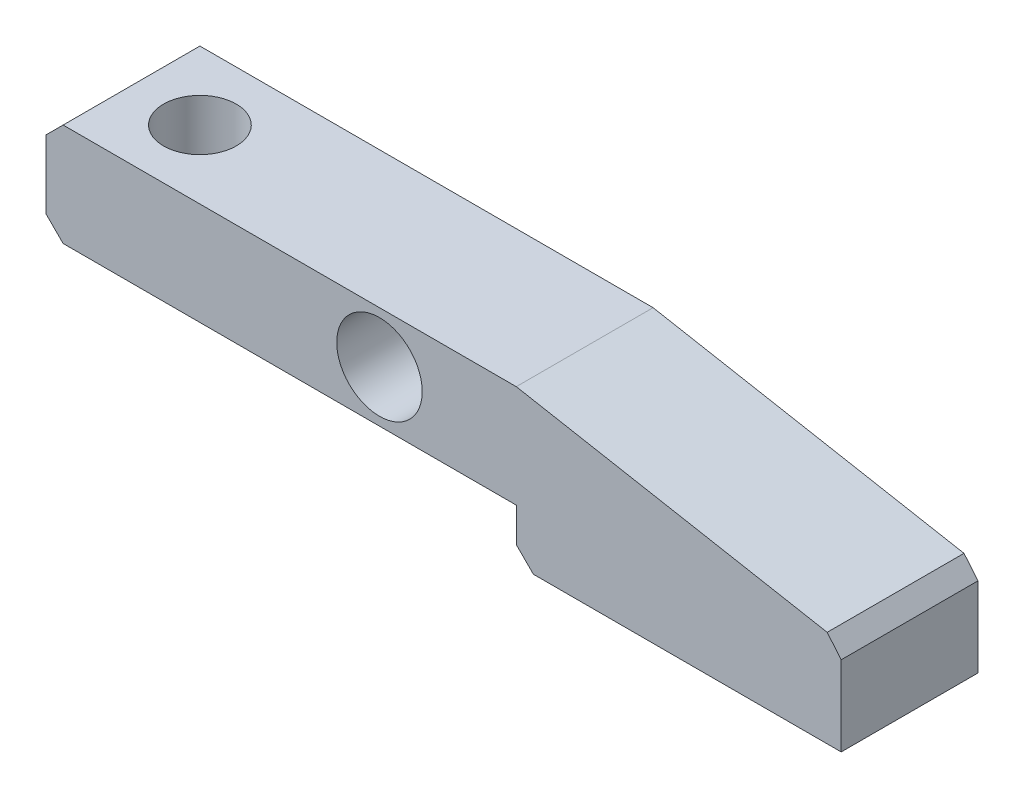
SolidWorks part; units mm, degrees
ref_plane "Face" through (0, 0, 0) normal (0, 0, 1) x (1, 0, 0)
ref_plane "Gauche" through (0, 0, 0) normal (0, 1, 0) x (1, 0, 0)
ref_plane "Dessus" through (0, 0, 0) normal (1, 0, 0) x (0, 0, -1)
sketch "Esquisse1" plane through (0, 0, 0) normal (0, 0, 1) x (1, 0, 0)
  line L0 (-93, 18) -> (-38, 18)
  line L1 (-38, 18) -> (0, 11)
  line L2 (0, 11) -> (0, 0)
  line L3 (0, 0) -> (-38, 0)
  line L4 (-38, 0) -> (-38, 6)
  line L5 (-38, 6) -> (-93, 6)
  line L6 (-93, 6) -> (-93, 18)
  dimension "D1" = 11
  dimension "D2" = 38
  dimension "D3" = 6
  dimension "D4" = 55
  dimension "D5" = 55
  dimension "D6" = 12
extrude "Base-Extrusion" add sketch "Esquisse1" along normal mid plane 16
hole_wizard "Perçage1" positions "Esquisse3" profile "Esquisse2" tap size "M10x1.5" standard "ISO"
sketch "Esquisse3" plane through (0, 18, 0) normal (0, 1, 0) x (-1, 0, 0)
  line L0 (38, 8) -> (93, 8) construction
  line L1 (93, 8) -> (93, -8) construction
  point P0 (83, 0)
  dimension "D1" = 8
  dimension "D2" = 10
sketch "Esquisse2" plane through (-83, 18, 0) normal (1, 0, 0) x (0, 0, 1)
  line L0 (0, 0) -> (0, 12)
  line L1 (0, 12) -> (4.25, 12)
  line L2 (4.25, 12) -> (4.25, 0)
  line L5 (4.25, 0) -> (0, 0)
  line L11 (0, -6.35) -> (0, 107.95) construction
  dimension "Diamètre du perçage jusqu'au prochain" = 8.5
  dimension "Profondeur du perçage jusqu'au prochain" = 12
hole_wizard "Perçage2" positions "Esquisse5" profile "Esquisse4" hole size "M1" standard "ISO"
sketch "Esquisse5" plane through (0, 0, 8) normal (0, 0, 1) x (1, 0, 0)
  line L0 (-93, 18) -> (-93, 6) construction
  line L1 (-38, 18) -> (-93, 18) construction
  point P0 (-54, 12)
  dimension "D1" = 39
  dimension "D2" = 6
sketch "Esquisse4" plane through (-54, 12, 8) normal (1, 0, 0) x (0, -1, 0)
  line L0 (0, 0) -> (0, 16)
  line L1 (0, 16) -> (5, 16)
  line L2 (5, 16) -> (5, 0)
  line L5 (5, 0) -> (0, 0)
  line L11 (0, -6.35) -> (0, 107.95) construction
  dimension "Diamètre du perçage jusqu'au prochain" = 10
  dimension "Profondeur du perçage jusqu'au prochain" = 16
chamfer "Chanfrein1" distance 2 angle 45
